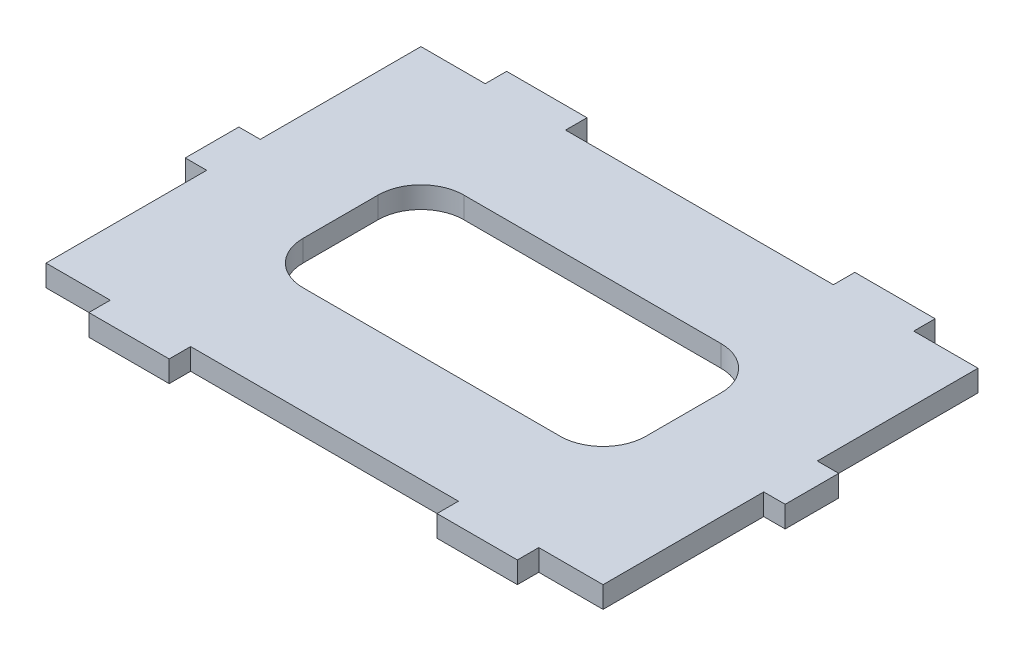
SolidWorks part; units mm, degrees
ref_plane "Ebene vorne" through (0, 0, 0) normal (0, 0, 1) x (1, 0, 0)
ref_plane "Ebene oben" through (0, 0, 0) normal (0, 1, 0) x (1, 0, 0)
ref_plane "Ebene rechts" through (0, 0, 0) normal (1, 0, 0) x (0, 0, -1)
sketch "Skizze1" plane through (0, 0, 0) normal (0, 1, 0) x (1, 0, 0)
  line L0 (0, 48.4677) -> (0, -69.9367) construction
  line L1 (-52, 35) -> (-40, 35)
  line L2 (-52, 35) -> (-52, 5)
  line L3 (-52, -35) -> (-40, -35)
  line L4 (52, 35) -> (52, 5)
  line L5 (-63.2683, 0) -> (64.2442, 0) construction
  line L6 (40, 35) -> (40, 39)
  line L7 (-24, 15) -> (24, 15)
  line L8 (-32, 7) -> (-32, -7)
  line L9 (-24, -15) -> (24, -15)
  line L10 (32, 7) -> (32, -7)
  line L11 (40, 35) -> (52, 35)
  line L12 (-40, 35) -> (-40, 39)
  line L13 (-40, 39) -> (-25, 39)
  line L14 (-25, 35) -> (-25, 39)
  line L15 (25, 35) -> (25, 39)
  line L16 (40, 39) -> (25, 39)
  line L17 (40, -39) -> (25, -39)
  line L18 (25, -35) -> (25, -39)
  line L19 (-25, -35) -> (-25, -39)
  line L20 (-40, -39) -> (-25, -39)
  line L21 (-40, -35) -> (-40, -39)
  line L22 (-52, -5) -> (-52, -35)
  line L23 (40, -35) -> (40, -39)
  line L24 (-25, 35) -> (25, 35)
  line L25 (40, -35) -> (52, -35)
  line L26 (-25, -35) -> (25, -35)
  line L27 (-52, 5) -> (-56, 5)
  line L28 (56, 5) -> (56, -5)
  line L29 (-52, -5) -> (-56, -5)
  line L30 (-56, 5) -> (-56, -5)
  line L31 (52, -5) -> (56, -5)
  line L32 (52, 5) -> (56, 5)
  line L33 (52, -5) -> (52, -35)
  arc A0 (-32, -7) -> (-24, -15) centre (-24, -7) ccw
  arc A1 (24, -15) -> (32, -7) centre (24, -7) ccw
  arc A2 (32, 7) -> (24, 15) centre (24, 7) ccw
  arc A3 (-24, 15) -> (-32, 7) centre (-24, 7) ccw
  dimension "D3" = 20
  dimension "D7" = 8
  dimension "D1" = 70
  dimension "D2" = 104
  dimension "D4" = 20
  dimension "D5" = 20
  dimension "D6" = 20
  dimension "D8" = 15
  dimension "D9" = 25
  dimension "D10" = 4
  dimension "D11" = 4
  dimension "D12" = 10
extrude "Aufsatz-Linear austragen1" add sketch "Skizze1" along normal blind 4
